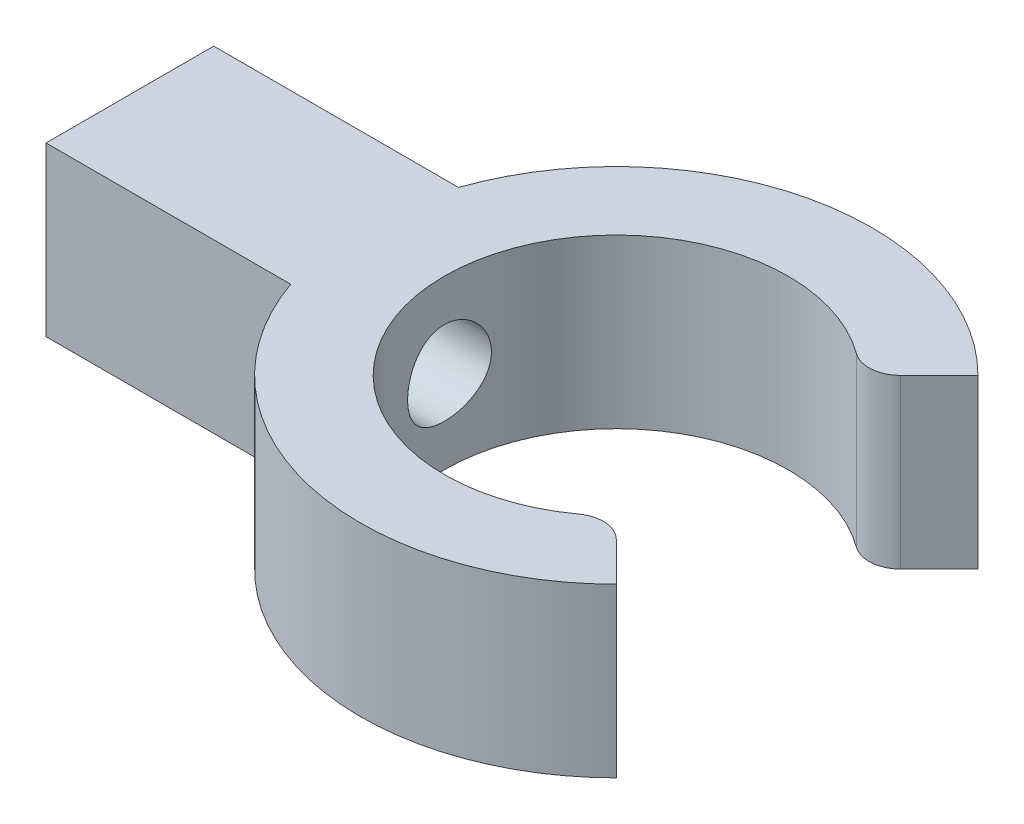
SolidWorks part; units mm, degrees
ref_plane "Front Plane" through (0, 0, 0) normal (0, 0, 1) x (1, 0, 0)
ref_plane "Top Plane" through (0, 0, 0) normal (0, 1, 0) x (1, 0, 0)
ref_plane "Right Plane" through (0, 0, 0) normal (1, 0, 0) x (0, 0, -1)
sketch "Sketch1" plane through (0, 0, 0) normal (0, 1, 0) x (1, 0, 0)
  line L0 (21.4983, -5.7983) -> (24.3267, -8.6267)
  line L1 (-7.5, -4) -> (7.5, -4)
  line L2 (-7.5, -4) -> (-7.5, 4)
  line L3 (-7.5, 4) -> (7.5, 4)
  line L4 (7.5, -4) -> (7.5, 4)
  line L5 (-7.5, -4) -> (7.5, 4) construction
  line L6 (-7.5, 4) -> (7.5, -4) construction
  line L7 (15.7, 0) -> (15.7, -12.2) construction
  line L8 (-55, 0) -> (55, 0) construction
  line L9 (21.4983, 5.7983) -> (24.3267, 8.6267)
  arc A0 (24.3267, 8.6267) -> (24.3267, -8.6267) centre (15.7, 0) ccw
  arc A1 (21.4983, 5.7983) -> (21.4983, -5.7983) centre (15.7, 0) ccw
  arc A2 (24.3267, -8.6267) -> (24.3267, 8.6267) centre (15.7, 0) ccw construction
  arc A3 (21.4983, -5.7983) -> (21.4983, 5.7983) centre (15.7, 0) ccw construction
  point P0 (0, 0)
  point P9 (7.5, 0)
  dimension "D3" = 16.4
  dimension "D4" = 4
  dimension "D1" = 15
  dimension "D2" = 8
  dimension "D5" = 45
extrude "Boss-Extrude1" add sketch "Sketch1" along normal blind 8 contours A0 L3 L2 L1 | L3 A0 L1 L4 | A1 L9 A0 L3 L4 | A1 L4 L1 A0 L0
fillet "Fillet1" radius 1.5 2 edges at (21.4983, 4, 5.7983) (21.4983, 4, -5.7983)
sketch "Sketch2" plane through (-7.5, 0, 0) normal (-1, 0, 0) x (0, 0, 1)
  line L1 (4, 8) -> (4, 0) construction
  line L2 (4, 0) -> (-4, 0) construction
  circle A0 centre (0, 4) radius 2
  point P7 (4, 4)
  point P8 (0, 0)
  dimension "D1" = 4
extrude "Cut-Extrude2" cut sketch "Sketch2" along normal through all and the other way through all
